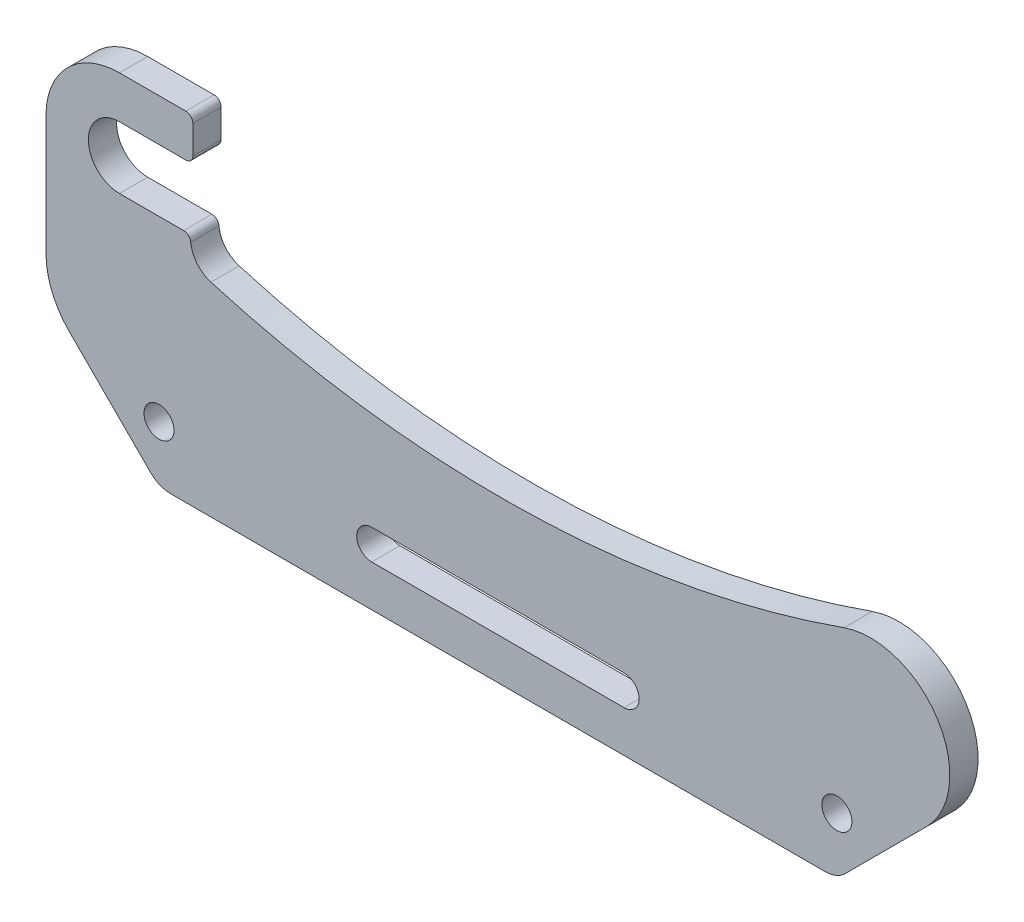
SolidWorks part; units mm, degrees
ref_plane "Front Plane" through (0, 0, 0) normal (0, 0, 1) x (1, 0, 0)
ref_plane "Top Plane" through (0, 0, 0) normal (0, 1, 0) x (1, 0, 0)
ref_plane "Right Plane" through (0, 0, 0) normal (1, 0, 0) x (0, 0, -1)
sketch "Sketch1" plane through (0, 0, 0) normal (0, 0, 1) x (1, 0, 0)
  line L1 (16.51, 6.985) -> (16.51, 16.51)
  line L2 (16.51, 16.51) -> (0, 16.51)
  line L3 (0, 6.985) -> (16.51, 6.985)
  line L4 (16.51, 6.985) -> (16.51, 0) construction
  line L5 (0, -6.985) -> (16.51, -6.985)
  line L6 (16.51, 0) -> (16.51, -6.985) construction
  line L8 (16.51, -59.69) -> (16.51, -6.985) construction
  line L9 (16.51, -59.69) -> (186.69, -59.69)
  line L18 (186.69, -6.985) -> (16.51, -6.985)
  line L19 (101.6, -6.985) -> (101.6, -59.69) construction
  line L20 (186.69, -6.985) -> (186.69, -59.69)
  line L21 (-16.51, 0) -> (-16.51, -59.69)
  line L22 (-16.51, -59.69) -> (16.51, -59.69)
  arc A0 (0, 6.985) -> (0, -6.985) centre (0, 0) ccw
  arc A2 (0, 16.51) -> (-16.51, 0) centre (0, 0) ccw
  dimension "D2" = 13.97
  dimension "D3" = 9.525
  dimension "D1" = 203.2
  dimension "D4" = 76.2
extrude "Boss-Extrude1" add sketch "Sketch1" along normal blind 6.35 contours L9 L20 L18 L5 A0 L3 L1 L2 A2 L21 L22
sketch "Sketch2" plane through (0, 0, 6.35) normal (0, 0, 1) x (1, 0, 0)
  line L0 (85.09, -59.69) -> (85.09, -6.985) construction
  line L3 (-16.51, -59.69) -> (186.69, -59.69) construction
  line L4 (186.69, -6.985) -> (0, -6.985) construction
  line L5 (53.34, -46.99) -> (85.09, -46.99) construction
  line L6 (85.09, -46.99) -> (116.84, -46.99) construction
  line L7 (-16.51, -46.99) -> (8.89, -46.99) construction
  line L8 (-16.51, 0) -> (-16.51, -59.69) construction
  line L9 (8.89, -46.99) -> (8.89, -59.69) construction
  line L10 (186.69, -46.99) -> (161.29, -46.99) construction
  line L11 (186.69, -6.985) -> (186.69, -59.69) construction
  line L12 (161.29, -46.99) -> (161.29, -59.69) construction
  dimension "D1" = 31.75
  dimension "D2" = 31.75
  dimension "D3" = 12.7
  dimension "D4" = 12.7
  dimension "D5" = 25.4
  dimension "D6" = 25.4
sketch "Sketch7" plane through (0, 0, 6.35) normal (0, 0, 1) x (1, 0, 0)
  line L0 (0, 0) -> (85.725, 0) construction
  line L1 (85.725, 0) -> (85.725, -59.69) construction
  line L3 (171.45, 0) -> (85.725, 0) construction
  line L4 (-16.51, -59.69) -> (186.69, -59.69) construction
  line L5 (85.725, 66.8572) -> (85.725, 0) construction
  line L6 (85.725, -23.3271) -> (85.725, 52.9699) construction
  line L7 (16.002, -12.573) -> (16.002, 0)
  line L8 (16.002, 0) -> (155.448, 0)
  line L9 (155.448, 0) -> (155.448, -12.573)
  line L10 (186.69, -6.985) -> (0, -6.985) construction
  circle A0 centre (0, 0) radius 6.985 construction
  circle A2 centre (171.45, 0) radius 6.985
  arc A3 (16.002, -12.573) -> (155.448, -12.573) centre (85.725, 208.0703) ccw
  arc A4 (0, 6.985) -> (0, -6.985) centre (0, 0) ccw construction
  dimension "D1" = 171.45
  dimension "D2" = 139.446
  dimension "D3" = 231.3974
  dimension "D4" = 5.588
extrude "Cut-Extrude1" cut sketch "Sketch7" against normal through all contours L8 L9 A3 L7
hole_wizard "1/4 Clearance Hole1" positions "Sketch10" profile "Sketch11" hole size "1/4" standard "ANSI Inch"
sketch "Sketch10" plane through (0, 0, 6.35) normal (0, 0, 1) x (1, 0, 0)
  point P0 (8.89, -46.99)
  point P2 (161.29, -46.99)
sketch "Sketch11" plane through (8.89, -46.99, 6.35) normal (1, 0, 0) x (0, -1, 0)
  line L0 (0, 0) -> (0, 6.35)
  line L1 (0, 6.35) -> (3.3782, 6.35)
  line L2 (3.3782, 6.35) -> (3.3782, 0)
  line L5 (3.3782, 0) -> (0, 0)
  line L11 (0, -6.35) -> (0, 107.95) construction
  dimension "Thru Hole Dia." = 6.7564
  dimension "Thru Hole Depth" = 6.35
sketch "Sketch12" plane through (0, 0, 6.35) normal (0, 0, 1) x (1, 0, 0)
  line L0 (8.89, -59.69) -> (-16.51, -34.29)
  line L1 (-16.51, -59.69) -> (186.69, -59.69) construction
  line L2 (-16.51, 0) -> (-16.51, -59.69) construction
  line L3 (-16.51, -34.29) -> (-22.86, -34.29)
  line L4 (-22.86, -34.29) -> (-22.86, -66.04)
  line L5 (85.09, -59.69) -> (85.09, -22.2125) construction
  line L6 (-22.86, -66.04) -> (8.89, -66.04)
  line L7 (8.89, -66.04) -> (8.89, -59.69)
  line L8 (85.09, -59.69) -> (85.09, -6.985) construction
  line L9 (161.29, -66.04) -> (161.29, -59.69)
  line L10 (193.04, -66.04) -> (161.29, -66.04)
  line L11 (193.04, -34.29) -> (193.04, -66.04)
  line L12 (186.69, -34.29) -> (193.04, -34.29)
  line L13 (161.29, -59.69) -> (186.69, -34.29)
  dimension "D1" = 45
  dimension "D2" = 152.4
  dimension "D3" = 6.35
  dimension "D4" = 6.35
  dimension "D5" = 6.35
extrude "Cut-Extrude2" cut sketch "Sketch12" against normal through all contours L10 L9 L13 L12 L11
sketch "Sketch15" plane through (0, 0, 6.35) normal (0, 0, 1) x (1, 0, 0)
  line L3 (181.4642, -39.5158) -> (194.1642, -39.5158)
  line L5 (194.1642, -39.5158) -> (194.1642, 0.127)
  line L6 (194.1642, 0.127) -> (155.448, 0.127)
  line L7 (155.448, 0.127) -> (155.448, -12.573)
  line L8 (186.69, -6.985) -> (186.69, -34.29) construction
  line L12 (186.69, -34.29) -> (161.29, -59.69) construction
  arc A0 (16.002, -12.573) -> (155.448, -12.573) centre (85.725, 208.0703) ccw construction
  arc A1 (155.448, -12.573) -> (162.8976, -10.0791) centre (85.725, 208.0703) ccw
  arc A2 (181.4642, -39.5158) -> (162.8976, -10.0791) centre (168.848, -26.8996) ccw
  dimension "D1" = 12.7
  dimension "D2" = 12.7
extrude "Cut-Extrude3" cut sketch "Sketch15" against normal through all
hole_wizard "1/4 Clearance Slot2" positions "Sketch16" profile "Sketch17" size "1/4" standard "ANSI Inch"
sketch "Sketch16" plane through (0, 0, 6.35) normal (0, 0, 1) x (1, 0, 0)
  line L0 (53.34, -46.99) -> (116.84, -46.99) construction
  point P0 (85.09, -46.99)
  dimension "D1" = 63.5
sketch "Sketch17" plane through (85.09, -46.99, 6.35) normal (1, 0, 0) x (0, -1, 0)
  line L0 (0, 0) -> (0, 6.35)
  line L1 (0, 6.35) -> (3.3782, 6.35)
  line L2 (3.3782, 6.35) -> (3.3782, 0)
  line L5 (3.3782, 0) -> (0, 0)
  line L11 (0, -6.35) -> (0, 107.95) construction
  dimension "Thru Hole Dia." = 6.7564
  dimension "Thru Hole Depth" = 6.35
fillet "Fillet1" radius 17.842 1 edges at (-16.51, -34.29, 3.175)
fillet "Fillet2" radius 6.35 3 edges at (161.29, -59.69, 3.175) (8.89, -59.69, 3.175) (16.002, -12.573, 3.175)
fillet "Fillet3" radius 1.5875 3 edges at (16.51, 16.51, 3.175) (16.002, -6.985, 3.175) (16.51, 6.985, 3.175)
